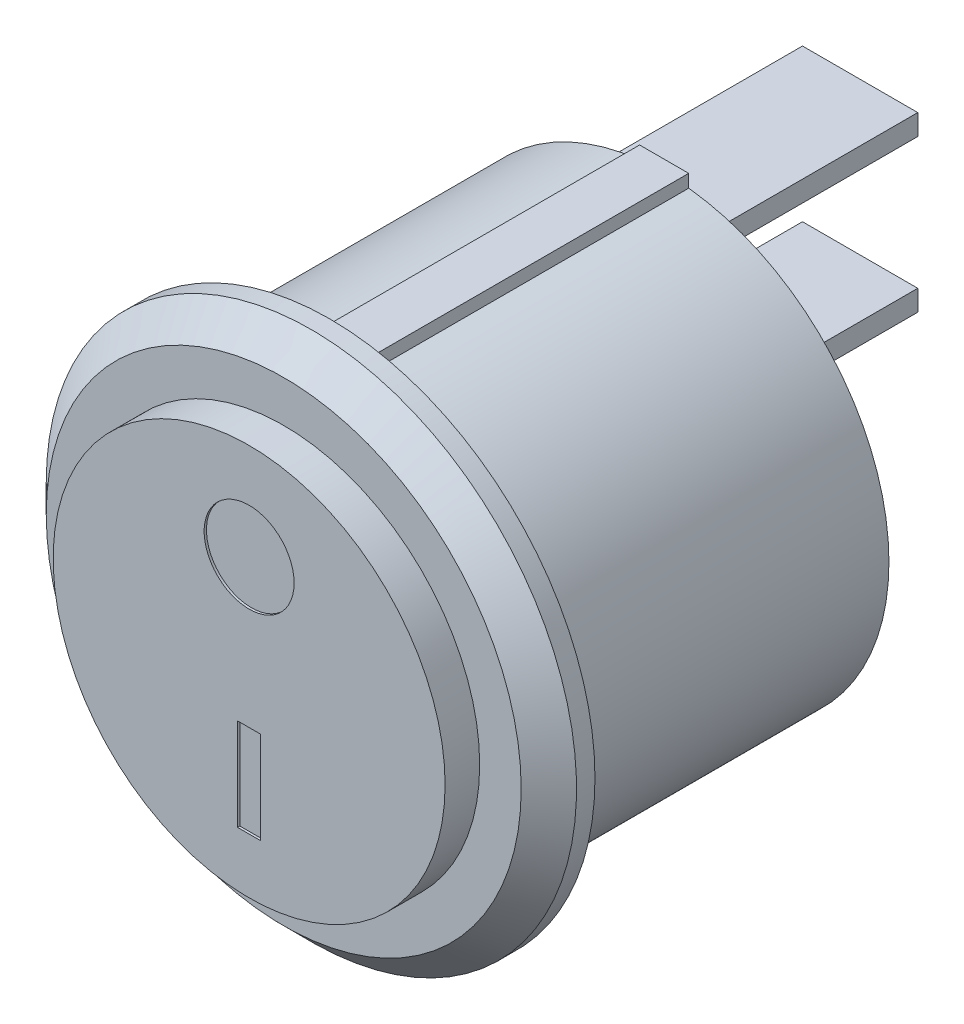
SolidWorks part; units mm, degrees
ref_plane "Ebene vorne" through (0, 0, 0) normal (0, 0, 1) x (1, 0, 0)
ref_plane "Ebene oben" through (0, 0, 0) normal (0, 1, 0) x (1, 0, 0)
ref_plane "Ebene rechts" through (0, 0, 0) normal (1, 0, 0) x (0, 0, -1)
sketch "Skizze1" plane through (0, 0, 0) normal (0, 0, 1) x (1, 0, 0)
  circle A0 centre (0, 0) radius 9.75
  dimension "D1" = 19.5
extrude "Aufsatz-Linear austragen1" add sketch "Skizze1" along normal blind 14.5
sketch "Skizze2" plane through (0, 0, 14.5) normal (0, 0, 1) x (1, 0, 0)
  circle A0 centre (0, 0) radius 11.5
  dimension "D1" = 23
extrude "Aufsatz-Linear austragen2" add sketch "Skizze2" along normal blind 2
chamfer "Fase1" distance 1.2 angle 45 1 edges at (11.5, 0, 16.5)
sketch "Skizze3" plane through (0, 0, 16.5) normal (0, 0, 1) x (1, 0, 0)
  circle A0 centre (0, 0) radius 8.5
  dimension "D1" = 17
extrude "Aufsatz-Linear austragen3" add sketch "Skizze3" along normal blind 1.5
sketch "Skizze4" plane through (0, 0, 18) normal (0, 0, 1) x (1, 0, 0)
  line L0 (0, -9.9) -> (0, 9.9) construction
  line L1 (-0.5, -2.1) -> (0.5, -2.1)
  line L2 (-0.5, -2.1) -> (-0.5, -6.1)
  line L3 (-0.5, -6.1) -> (0.5, -6.1)
  line L4 (0.5, -2.1) -> (0.5, -6.1)
  circle A0 centre (0, 4.3) radius 1.9505
  point P6 (0, 0)
  point P10 (0, -2.1)
  point P11 (0, 4.2099)
  dimension "D2" = 3.901
  dimension "D1" = 4
  dimension "D3" = 1
  dimension "D4" = 6.4
  dimension "D5" = 4.3
extrude "Schnitt-Linear austragen1" cut sketch "Skizze4" against normal blind 0.1
sketch "Skizze5" plane through (0, 0, 0) normal (0, 0, -1) x (-1, 0, 0)
  line L0 (0, 9.9) -> (0, -9.9) construction
  line L1 (-2.5, 9) -> (2.5, 9)
  line L2 (-2.5, 9) -> (-2.5, 8.1)
  line L3 (-2.5, 8.1) -> (2.5, 8.1)
  line L4 (2.5, 9) -> (2.5, 8.1)
  line L5 (-2.5, 2.4) -> (2.5, 2.4)
  line L6 (-2.5, 2.4) -> (-2.5, 1.5)
  line L7 (-2.5, 1.5) -> (2.5, 1.5)
  line L8 (2.5, 2.4) -> (2.5, 1.5)
  point P8 (0, 2.4)
  point P9 (0, 9)
  dimension "D1" = 5
  dimension "D2" = 0.9
  dimension "D3" = 7.5
  dimension "D4" = 9
extrude "Aufsatz-Linear austragen4" add sketch "Skizze5" along normal blind 8.5
sketch "Skizze6" plane through (0, 0, 0) normal (0, 0, -1) x (-1, 0, 0)
  line L0 (0, 12.65) -> (0, -12.65) construction
  line L1 (-1.0652, 10.25) -> (1.0652, 10.25)
  line L2 (-1.0652, 10.25) -> (-1.0652, -10.25)
  line L3 (-1.0652, -10.25) -> (1.0652, -10.25)
  line L4 (1.0652, 10.25) -> (1.0652, -10.25)
  line L5 (12.65, 0) -> (-12.65, 0) construction
  point P4 (0, 10.25)
  point P7 (1.0652, 0)
  dimension "D1" = 20.5
extrude "Aufsatz-Linear austragen5" add sketch "Skizze6" against normal up to surface (14.5 mm away)
